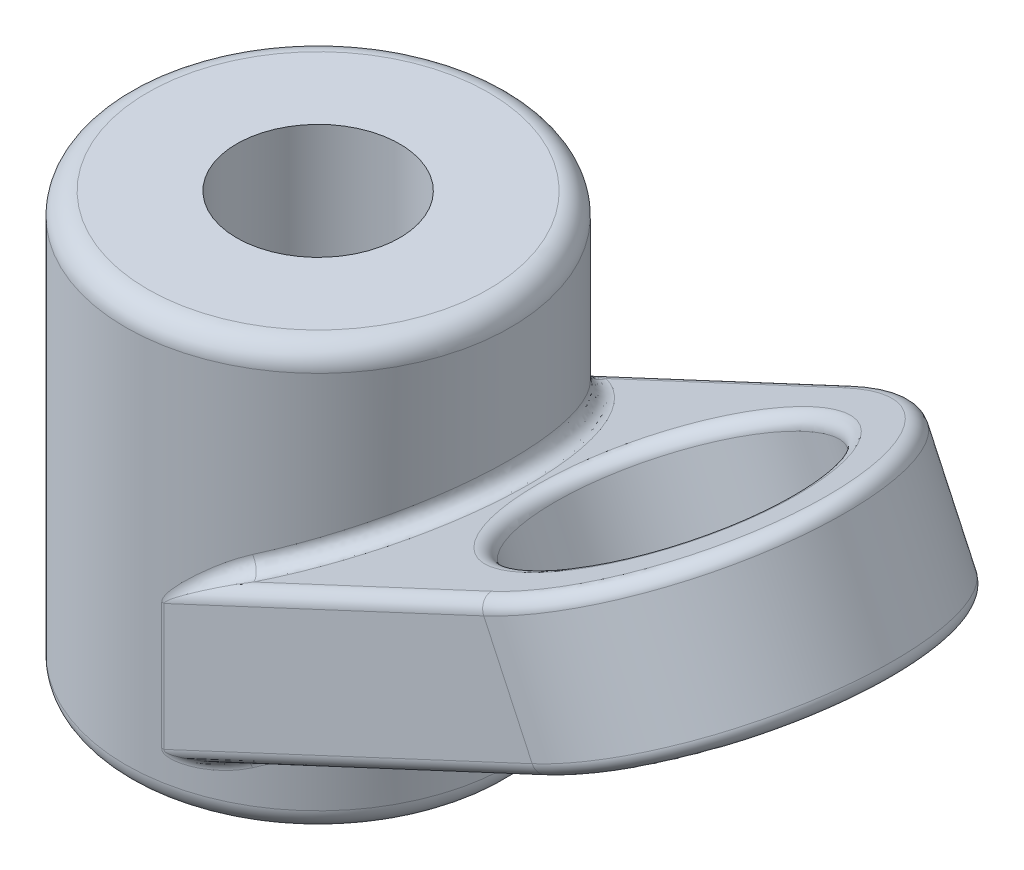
SolidWorks part; units mm, degrees
ref_plane "Plane1" through (0, 0, 0) normal (0, 0, 1) x (1, 0, 0)
ref_plane "Plane2" through (0, 0, 0) normal (0, 1, 0) x (1, 0, 0)
ref_plane "Plane3" through (0, 0, 0) normal (1, 0, 0) x (0, 0, -1)
sketch "Esquisse1" plane through (0, 0, 0) normal (0, 0, 1) x (1, 0, 0)
  line L0 (-38.7, 96) -> (-18.5, 96)
  line L1 (-43.7, 91) -> (-43.7, 5)
  line L2 (-33.7, 0) -> (-38.7, 0)
  line L3 (-18.5, 4) -> (-18.5, 96)
  line L4 (-33.7, 4) -> (-33.7, 0)
  line L5 (-33.7, 4) -> (-18.5, 4)
  line L6 (0, 101.2789) -> (0, -43.6652) construction
  arc A0 (-43.7, 91) -> (-38.7, 96) centre (-38.7, 91) cw
  arc A1 (-38.7, 0) -> (-43.7, 5) centre (-38.7, 5) cw
  point P14 (-43.7, 96)
  point P17 (-43.7, 0)
revolve "Base-Révolution" add sketch "Esquisse1" angle 360 about L6
ref_plane "Plan4" through (0, 22.3, 0) normal (0, 1, 0) x (-1, 0, 0)
sketch "Esquisse4" plane through (0, 22.3, 0) normal (0, 1, 0) x (-1, 0, 0)
  line L0 (0, 45.3889) -> (0, -47.2361) construction
ref_plane "Plan5" through (-8.5414, 18.3171, 0) normal (-0.4226, 0.9063, 0) x (-0.9063, -0.4226, 0)
sketch "Esquisse5" plane through (-8.5414, 18.3171, 0) normal (-0.4226, 0.9063, 0) x (-0.9063, -0.4226, 0)
  line L0 (-81.3926, 0) -> (137.5608, 0) construction
  line L1 (-9.4244, 45.3889) -> (-9.4244, -47.2361) construction
  line L2 (-104.4244, 43) -> (-57.6418, 43)
  line L3 (-104.4244, -43) -> (-57.6418, -43)
  line L4 (-57.6418, 43) -> (-57.6418, -43)
  circle A0 centre (-104.4244, 0) radius 25.6
  arc A1 (-104.4244, 43) -> (-104.4244, -43) centre (-104.4244, 0) ccw
extrude "Boss.-Extru.1" add sketch "Esquisse5" along normal mid plane 32
sketch "Esquisse7" plane through (52.2412, 24.3605, 0) normal (-0.9063, -0.4226, 0) x (0, 0, 1)
  line L3 (-23.3512, 36.2107) -> (-43, 36.2107)
  line L4 (-23.3512, 36.2107) -> (-43, 36.2107)
  line L5 (43, 36.2107) -> (23.3512, 36.2107)
  line L8 (-43, 36.2107) -> (-43, 4.2107)
  line L9 (43, 4.2107) -> (43, 36.2107)
  line L10 (43, 36.2107) -> (23.3512, 36.2107)
  line L11 (-43, 36.2107) -> (-43, 4.2107)
  line L12 (-43, 4.2107) -> (43, 4.2107)
  line L13 (-43, 4.2107) -> (43, 4.2107)
  line L14 (43, 4.2107) -> (43, 36.2107)
  ellipse E1 centre (0, 123.6132) end of major axis (0, 227.0162) minor radius 43.7 (-23.3512, 36.2107) -> (23.3512, 36.2107) ccw
  ellipse E2 centre (0, 123.6132) end of major axis (0, 227.0162) minor radius 43.7 (-23.3512, 36.2107) -> (23.3512, 36.2107) ccw
  dimension "D1" = 0
extrude "Boss.-Extru.2" add sketch "Esquisse7" along normal up to next
sketch "Esquisse9" plane through (-15.3033, 32.818, 0) normal (-0.4226, 0.9063, 0) x (-0.9063, -0.4226, 0)
  circle A0 centre (-104.4244, 0) radius 29.6
  dimension "D1" = 59.2
extrude "Enlèv. mat.-Extru.2" cut sketch "Esquisse9" against normal blind 23
fillet "Congé5" radius 3 12 edges at (43.7, 60.3317, 0) (118.3086, 95.1222, 0) (43.5639, 60.2682, -43) (50.3258, 28.1132, 43) (69.6597, 37.1288, 0) (131.8324, 66.1204, 0) (50.3258, 28.1132, -43) (43.5639, 60.2682, 43) (43.7, 25.0236, 0) (7.7904, 25.9327, -43) (7.7904, 25.9327, 43) (52.5106, 64.4402, 0)
equation "\"D4@Esquisse5\" = \"D1@Esquisse5\" - \"D3@Esquisse1\" / cos(\"D1@Plan5\"*0.01745293)"
